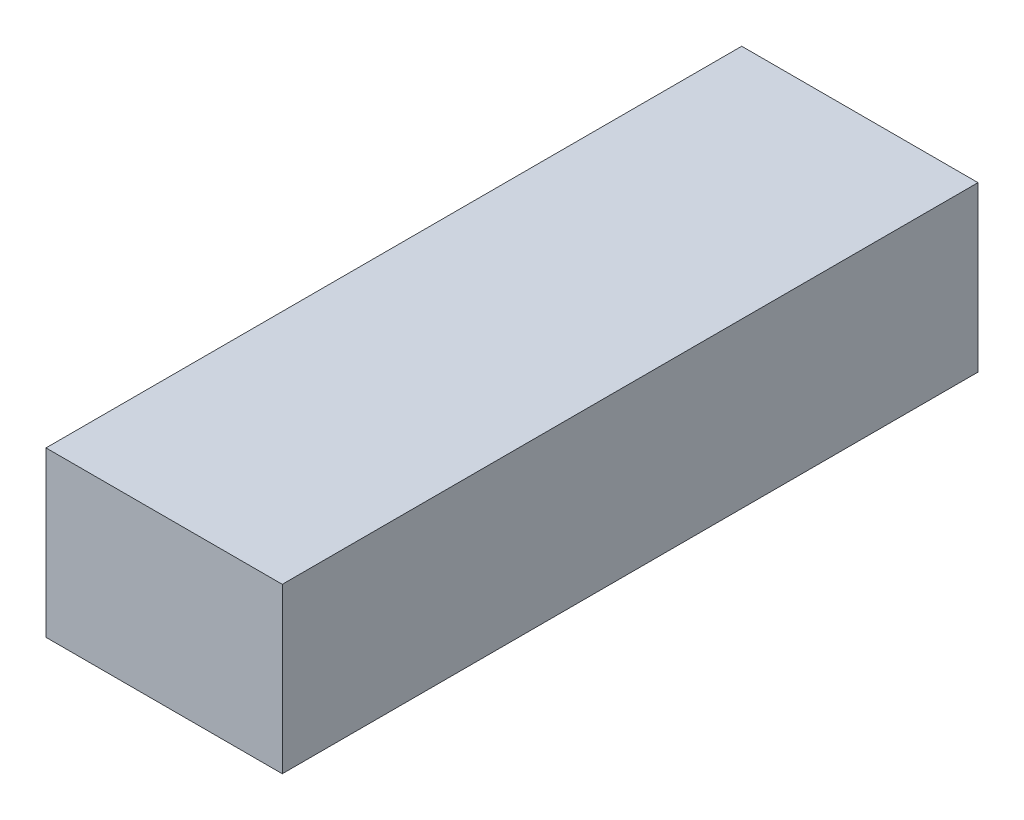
SolidWorks part; units mm, degrees
ref_plane "Front Plane" through (0, 0, 0) normal (0, 0, 1) x (1, 0, 0)
ref_plane "Top Plane" through (0, 0, 0) normal (0, 1, 0) x (1, 0, 0)
ref_plane "Right Plane" through (0, 0, 0) normal (1, 0, 0) x (0, 0, -1)
sketch "Sketch1" plane through (0, 0, 0) normal (0, 0, 1) x (1, 0, 0)
  line L1 (0, 0) -> (36, 0)
  line L2 (0, 0) -> (0, 25)
  line L3 (0, 25) -> (36, 25)
  line L4 (36, 0) -> (36, 25)
  dimension "D1" = 36
  dimension "D2" = 25
extrude "Boss-Extrude1" add sketch "Sketch1" along normal blind 106
